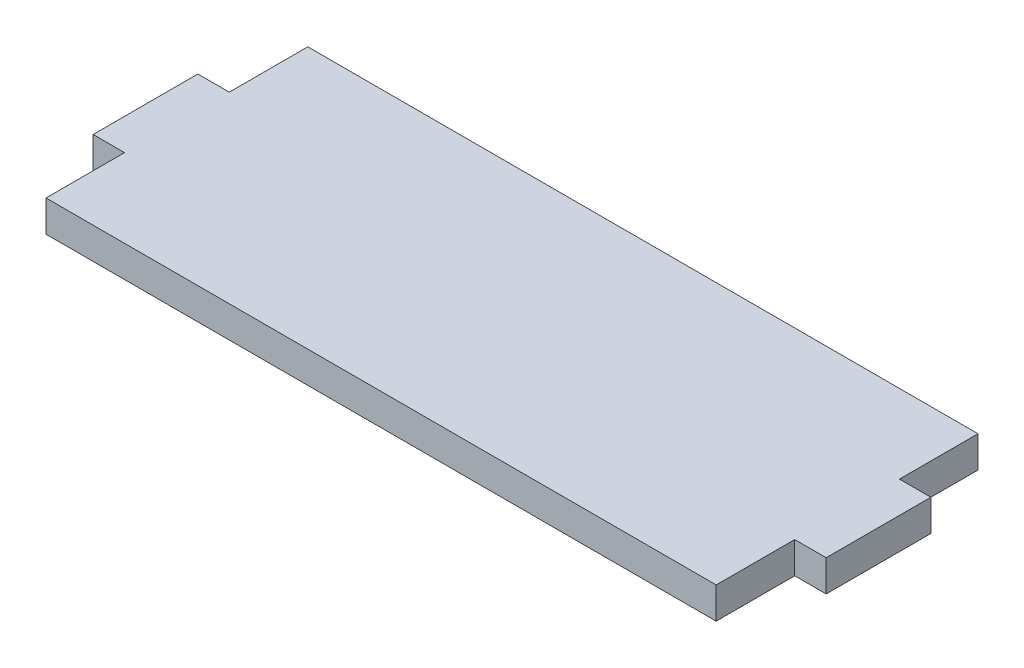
SolidWorks part; units mm, degrees
ref_plane "Front Plane" through (0, 0, 0) normal (0, 0, 1) x (1, 0, 0)
ref_plane "Top Plane" through (0, 0, 0) normal (0, 1, 0) x (1, 0, 0)
ref_plane "Right Plane" through (0, 0, 0) normal (1, 0, 0) x (0, 0, -1)
sketch "Sketch1" plane through (0, 0, 0) normal (0, 1, 0) x (1, 0, 0)
  line L0 (28.171, -14.6949) -> (28.171, -7.1949)
  line L1 (-35.829, -7.1949) -> (28.171, -7.1949)
  line L2 (-38.829, -14.6949) -> (-38.829, -24.6949)
  line L3 (-35.829, -32.1949) -> (28.171, -32.1949)
  line L4 (31.171, -14.6949) -> (31.171, -24.6949)
  line L6 (-35.829, -14.6949) -> (-38.829, -14.6949)
  line L9 (-35.829, -24.6949) -> (-38.829, -24.6949)
  line L10 (31.171, -14.6949) -> (28.171, -14.6949)
  line L11 (31.171, -24.6949) -> (28.171, -24.6949)
  line L12 (-35.829, -24.6949) -> (-35.829, -32.1949)
  line L13 (28.171, -32.1949) -> (28.171, -24.6949)
  line L14 (-35.829, -7.1949) -> (-35.829, -14.6949)
extrude "Boss-Extrude1" add sketch "Sketch1" along normal blind 3
